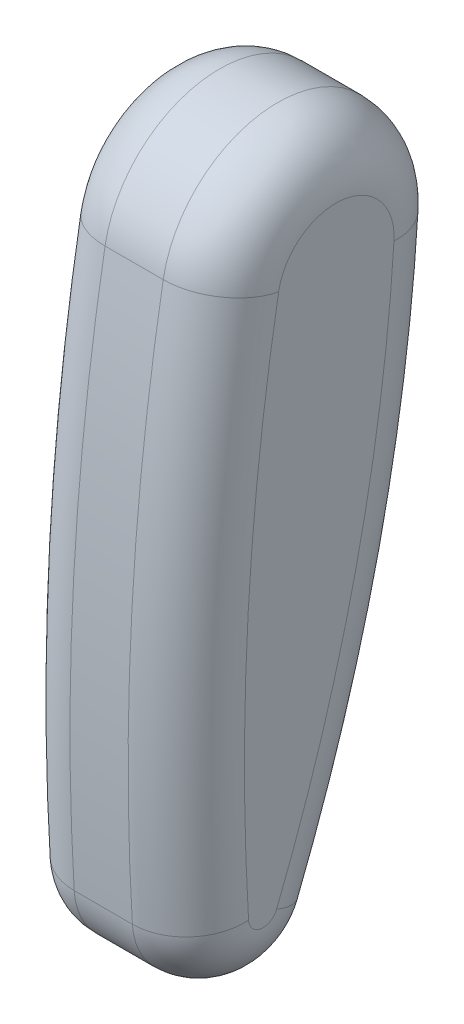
SolidWorks part; units mm, degrees
ref_plane "Plan de face" through (0, 0, 0) normal (0, 0, 1) x (1, 0, 0)
ref_plane "Plan de dessus" through (0, 0, 0) normal (0, 1, 0) x (1, 0, 0)
ref_plane "Plan de droite" through (0, 0, 0) normal (1, 0, 0) x (0, 0, -1)
body saved out of another part "Stock-Bonhomme 3D Articulé-1"
